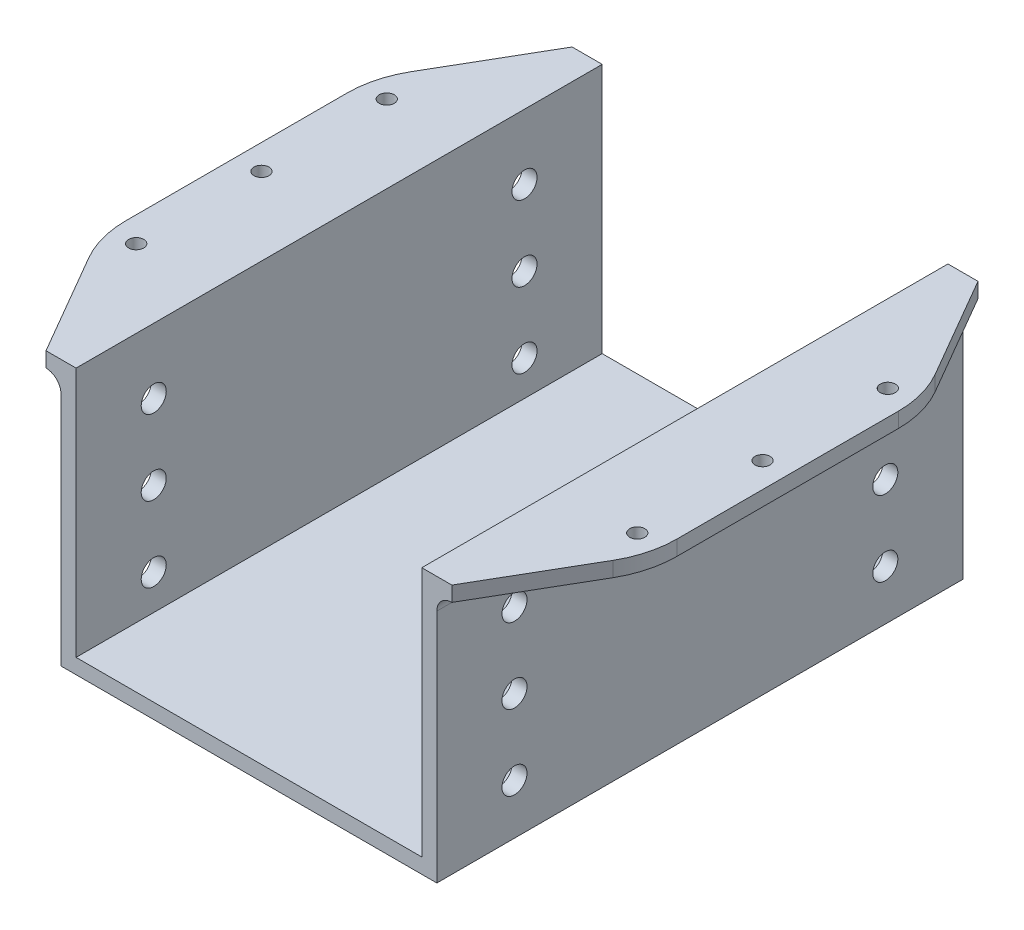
SolidWorks part; units mm, degrees
ref_plane "前视基准面" through (0, 0, 0) normal (0, 0, 1) x (1, 0, 0)
ref_plane "上视基准面" through (0, 0, 0) normal (0, 1, 0) x (1, 0, 0)
ref_plane "右视基准面" through (0, 0, 0) normal (1, 0, 0) x (0, 0, -1)
other "Configuration Table"
sketch "草图1" plane through (0, 0, 0) normal (0, 0, 1) x (1, 0, 0)
  line L2 (-32.5, 23.5) -> (-32.5, -23.5)
  line L3 (-32.5, -23.5) -> (32.5, -23.5)
  line L4 (32.5, 23.5) -> (32.5, -23.5)
  line L5 (0, -23.5) -> (0, 27.5) construction
  line L6 (-32.5, 0) -> (32.5, 0) construction
  line L7 (-35.5, -26.5) -> (35.5, -26.5)
  line L10 (-35.5, 26.5) -> (35.5, 26.5) construction
  line L11 (-35.5, 26.5) -> (-35.5, -26.5) construction
  line L12 (35.5, 26.5) -> (35.5, -26.5) construction
  line L14 (35.5, 26.5) -> (55, 26.5)
  line L18 (-35.5, -26.5) -> (-35.5, 23.5)
  line L19 (-35.5, 23.5) -> (-55, 23.5)
  line L20 (-55, 23.5) -> (-55, 26.5)
  line L21 (-55, 26.5) -> (-32.5, 26.5)
  line L22 (-32.5, 26.5) -> (-32.5, 23.5)
  line L23 (35.5, 23.5) -> (55, 23.5)
  line L24 (-32.5, 23.5) -> (32.5, 23.5) construction
  line L25 (55, 23.5) -> (55, 26.5)
  line L26 (35.5, 26.5) -> (32.5, 26.5)
  line L27 (32.5, 26.5) -> (32.5, 23.5)
  line L28 (35.5, 23.5) -> (35.5, -26.5)
  point P0 (0, 0)
  dimension "D1" = 65
  dimension "D2" = 3
  dimension "D4" = 3
  dimension "D5" = 50
  dimension "D6" = 50
  dimension "D7" = 55
  dimension "D8" = 55
  dimension "D3" = 3
extrude "凸台-拉伸1" add sketch "草图1" along normal blind 105
sketch "草图5" plane through (0, 26.5, 0) normal (0, 1, 0) x (1, 0, 0)
  line L0 (0, 0) -> (0, -105) construction
  line L1 (32.5, -105) -> (-32.5, -105) construction
  line L2 (-40.5, -105) -> (-55, -105)
  line L3 (-32.5, -105) -> (-55, -105) construction
  line L4 (-55, -105) -> (-55, -80)
  line L5 (-55, -105) -> (-55, 0) construction
  line L6 (-55, -80) -> (-40.5, -105)
  line L7 (-55, -52.5) -> (55, -52.5) construction
  line L8 (55, -105) -> (55, 0) construction
  line L9 (55, -105) -> (55, -80)
  line L10 (40.5, -105) -> (55, -105)
  line L11 (55, -80) -> (40.5, -105)
  line L12 (40.5, 0) -> (55, 0)
  line L13 (55, -25) -> (40.5, 0)
  line L14 (55, 0) -> (55, -25)
  line L15 (-55, 0) -> (-55, -25)
  line L16 (-40.5, 0) -> (-55, 0)
  line L17 (-55, -25) -> (-40.5, 0)
  circle A0 centre (-50, -52.5) radius 1.5
  circle A1 centre (-50, -27.5) radius 1.5
  circle A2 centre (-50, -77.5) radius 1.5
  circle A3 centre (50, -77.5) radius 1.5
  circle A4 centre (50, -52.5) radius 1.5
  circle A5 centre (50, -27.5) radius 1.5
  dimension "D1" = 50
  dimension "D2" = 25
  dimension "D3" = 25
extrude "切除-拉伸3" cut sketch "草图5" against normal blind 3
fillet "圆角9" radius 20 4 edges at (-55, 25, 80) (-55, 25, 25) (55, 25, 25) (55, 25, 80)
sketch "草图8" plane through (-35.5, 0, 0) normal (-1, 0, 0) x (0, 0, 1)
  line L4 (0, 23.5) -> (0, -26.5)
  line L5 (0, -26.5) -> (105, -26.5)
  line L6 (105, -26.5) -> (105, 23.5)
  line L7 (105, 23.5) -> (0, 23.5)
  line L8 (0, 23.5) -> (0, -26.5)
  line L9 (0, -26.5) -> (105, -26.5)
  line L10 (105, -26.5) -> (105, 23.5)
  line L11 (105, 23.5) -> (0, 23.5)
  dimension "D1" = 0
extrude "凸台-拉伸3" add sketch "草图8" along normal blind 2
sketch "草图9" plane through (-32.5, 0, 0) normal (1, 0, 0) x (0, 0, -1)
  line L4 (0, -23.5) -> (0, 26.5)
  line L5 (0, 26.5) -> (-105, 26.5)
  line L6 (-105, 26.5) -> (-105, -23.5)
  line L7 (-105, -23.5) -> (0, -23.5)
  line L8 (0, -23.5) -> (0, 26.5)
  line L9 (0, 26.5) -> (-105, 26.5)
  line L10 (-105, 26.5) -> (-105, -23.5)
  line L11 (-105, -23.5) -> (0, -23.5)
  dimension "D1" = 0
extrude "切除-拉伸5" cut sketch "草图9" against normal blind 2
sketch "草图10" plane through (35.5, 0, 0) normal (1, 0, 0) x (0, 0, -1)
  line L4 (0, -26.5) -> (0, 23.5)
  line L5 (0, 23.5) -> (-105, 23.5)
  line L6 (-105, 23.5) -> (-105, -26.5)
  line L7 (-105, -26.5) -> (0, -26.5)
  line L8 (0, -26.5) -> (0, 23.5)
  line L9 (0, 23.5) -> (-105, 23.5)
  line L10 (-105, 23.5) -> (-105, -26.5)
  line L11 (-105, -26.5) -> (0, -26.5)
  dimension "D1" = 0
extrude "凸台-拉伸4" add sketch "草图10" along normal blind 2
sketch "草图11" plane through (32.5, 0, 0) normal (-1, 0, 0) x (0, 0, 1)
  line L4 (0, 26.5) -> (0, -23.5)
  line L5 (0, -23.5) -> (105, -23.5)
  line L6 (105, -23.5) -> (105, 26.5)
  line L7 (105, 26.5) -> (0, 26.5)
  line L8 (0, 26.5) -> (0, -23.5)
  line L9 (0, -23.5) -> (105, -23.5)
  line L10 (105, -23.5) -> (105, 26.5)
  line L11 (105, 26.5) -> (0, 26.5)
  dimension "D1" = 0
extrude "切除-拉伸6" cut sketch "草图11" against normal blind 2
fillet "圆角12" radius 3 2 edges at (-37.5, 23.5, 52.5) (37.5, 23.5, 52.5)
sketch "草图12" plane through (-37.5, 0, 0) normal (-1, 0, 0) x (0, 0, 1)
  line L0 (52.5, -26.5) -> (52.5, 26.5) construction
  line L1 (0, -26.5) -> (105, -26.5) construction
  line L2 (74.6197, 26.5) -> (30.3803, 26.5) construction
  circle A0 centre (89.5, -1.5) radius 2.5
  circle A1 centre (15.5, -1.5) radius 2.5
  dimension "D1" = 37
  dimension "D2" = 25
extrude "切除-拉伸7" cut sketch "草图12" against normal through all
pattern_linear "阵列(线性)1" count 2 spacing 15 along (0, -1, 0) count 2 spacing 15 along (0, 1, 0) of "切除-拉伸7"
